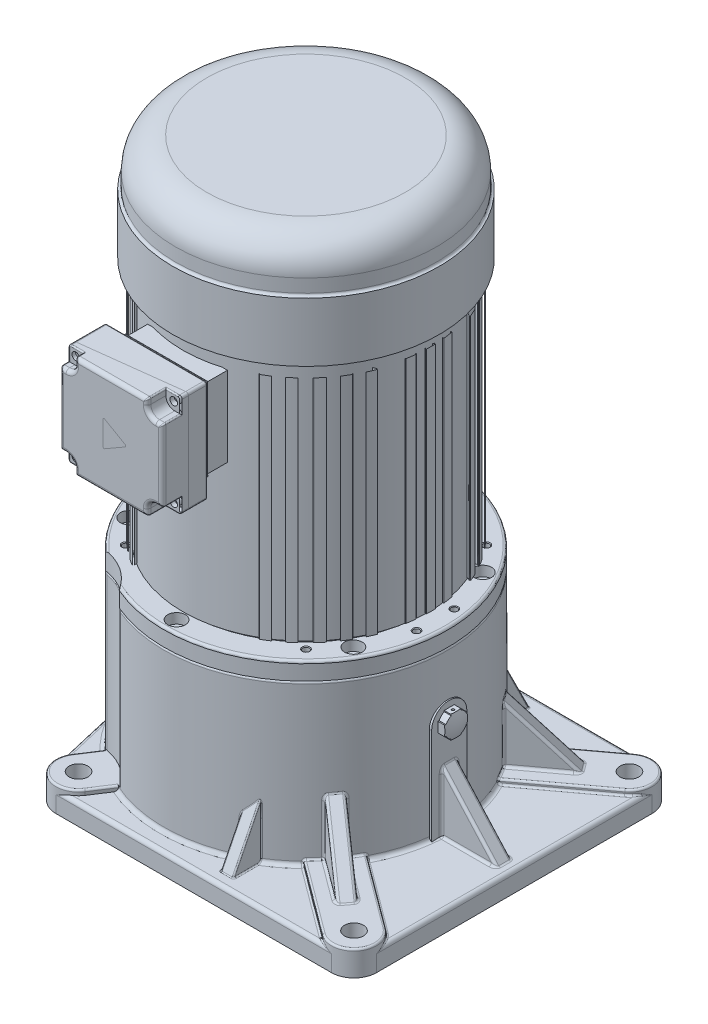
SolidWorks part; units mm, degrees
ref_plane "前视基准面" through (0, 0, 0) normal (0, 0, 1) x (1, 0, 0)
ref_plane "上视基准面" through (0, 0, 0) normal (0, 1, 0) x (1, 0, 0)
ref_plane "右视基准面" through (0, 0, 0) normal (1, 0, 0) x (0, 0, -1)
imported_body "接线盒座-1-surface1"
imported_body "接线盒座-1-surface2"
imported_body "接线盒座-1-surface3"
imported_body "接线盒座-1-surface4"
imported_body "接线盒座-1-surface5"
imported_body "接线盒盖-1-surface1"
imported_body "接线盒盖-1-surface2"
imported_body "接线盒盖-1-surface3"
imported_body "15.07.07 40箱盖(新)-1-surface1"
imported_body "5034.2200.106-00-1-surface2"
imported_body "5034.2200.106-00-1-surface3"
imported_body "5034.2200.106-00-1-surface4"
imported_body "5034.2200.106-00-1-surface5"
imported_body "5034.2200.106-00-1-surface6"
imported_body "5034.2200.106-00-1-surface7"
imported_body "5034.2200.106-00-1-surface8"
imported_body "5034.2200.106-00-1-surface9"
imported_body "5034.2200.106-00-1-surface10"
imported_body "5034.2200.106-00-1-surface11"
imported_body "5034.2200.106-00-1-surface12"
imported_body "5034.2200.106-00-1-surface13"
imported_body "5034.2200.106-00-1-surface14"
imported_body "5034.2200.106-00-1-surface15"
imported_body "5034.2200.106-00-1-surface16"
imported_body "5034.2200.106-00-1-surface17"
imported_body "5034.2200.106-00-1-surface18"
imported_body "5034.2200.106-00-1-surface19"
imported_body "5034.2200.106-00-1-surface20"
imported_body "5034.2200.106-00-1-surface21"
imported_body "5034.2200.106-00-1-surface22"
imported_body "5034.2200.106-00-1-surface23"
imported_body "5034.2200.106-00-1-surface24"
imported_body "5034.2200.106-00-1-surface25"
imported_body "5034.2200.106-00-1-surface26"
imported_body "5034.2200.106-00-1-surface27"
imported_body "5034.2200.106-00-1-surface28"
imported_body "5034.2200.106-00-1-surface29"
imported_body "5034.2200.106-00-1-surface30"
imported_body "5034.2200.106-00-1-surface31"
imported_body "5034.2200.106-00-1-surface32"
imported_body "5034.2200.106-00-1-surface33"
imported_body "5034.2200.106-00-1-surface34"
imported_body "5034.2200.106-00-1-surface35"
imported_body "5034.2200.106-00-1-surface36"
imported_body "5034.2200.106-00-1-surface37"
imported_body "5034.2200.106-00-1-surface38"
imported_body "5034.2200.106-00-1-surface39"
imported_body "5034.2200.106-00-1-surface40"
imported_body "5034.2200.106-00-1-surface41"
imported_body "5034.2200.106-00-1-surface42"
imported_body "5034.2200.106-00-1-surface43"
imported_body "5034.2200.106-00-1-surface44"
imported_body "5034.2200.106-00-1-surface45"
imported_body "5034.2200.106-00-1-surface46"
imported_body "5034.2200.106-00-1-surface47"
imported_body "5034.2200.106-00-1-surface48"
imported_body "5034.2200.106-00-1-surface49"
imported_body "5034.2200.106-00-1-surface50"
imported_body "5034.2200.106-00-1-surface51"
imported_body "5034.2200.106-00-1-surface52"
imported_body "5034.2200.106-00-1-surface53"
imported_body "5034.2200.106-00-1-surface54"
imported_body "5034.2200.106-00-1-surface55"
imported_body "5034.2200.106-00-1-surface56"
imported_body "5034.2200.106-00-1-surface57"
imported_body "5034.2200.106-00-1-surface58"
imported_body "5034.2200.106-00-1-surface59"
imported_body "5034.2200.106-00-1-surface60"
imported_body "5034.2200.106-00-1-surface61"
imported_body "5034.2200.106-00-1-surface62"
imported_body "5034.2200.106-00-1-surface63"
imported_body "5034.2200.106-00-1-surface64"
imported_body "5034.2200.106-00-1-surface65"
imported_body "15.04.15 40立式箱体新(D版)-1-surface1"
imported_body "15.04.15 40立式箱体新(D版)-1-surface2"
imported_body "透气塞-1-surface1"
sketch "草图1" plane through (0, -125.8619, 0) normal (0, 1, 0) x (1, 0, 0)
  circle A0 centre (178.2663, 335.6359) radius 98
extrude "凸台-拉伸1" add sketch "草图1" along normal blind 195
sketch "草图2" plane through (0, 69.1381, 0) normal (0, 1, 0) x (1, 0, 0)
  circle A0 centre (178.2663, 335.6359) radius 106
extrude "凸台-拉伸2" add sketch "草图2" along normal blind 47
sketch "草图3" plane through (0, 116.1381, 0) normal (0, 1, 0) x (1, 0, 0)
  circle A0 centre (178.2663, 335.6359) radius 104
extrude "凸台-拉伸3" add sketch "草图3" along normal blind 37.5
fillet "圆角1" radius 2 1 edges at (178.2663, 116.1381, -231.6359)
fillet "圆角2" radius 25 1 edges at (178.2663, 153.6381, -231.6359)
